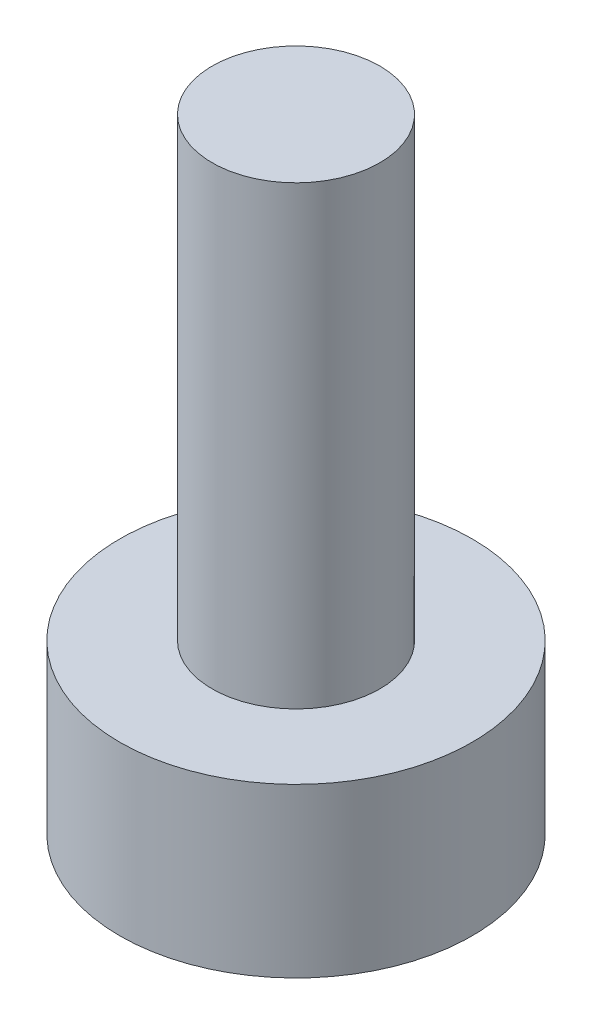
SolidWorks part; units mm, degrees
ref_plane "Front Plane" through (0, 0, 0) normal (0, 0, 1) x (1, 0, 0)
ref_plane "Top Plane" through (0, 0, 0) normal (0, 1, 0) x (1, 0, 0)
ref_plane "Right Plane" through (0, 0, 0) normal (1, 0, 0) x (0, 0, -1)
sketch "Sketch1" plane through (0, 0, 0) normal (0, 1, 0) x (1, 0, 0)
  circle A0 centre (0, 0) radius 3.683
extrude "Extrude1" add sketch "Sketch1" along normal blind 3.5052
sketch "Sketch2" plane through (0, 3.5052, 0) normal (0, 1, 0) x (-1, 0, 0)
  circle A0 centre (0, 0) radius 1.7526
extrude "Extrude2" add sketch "Sketch2" along normal blind 9.525
